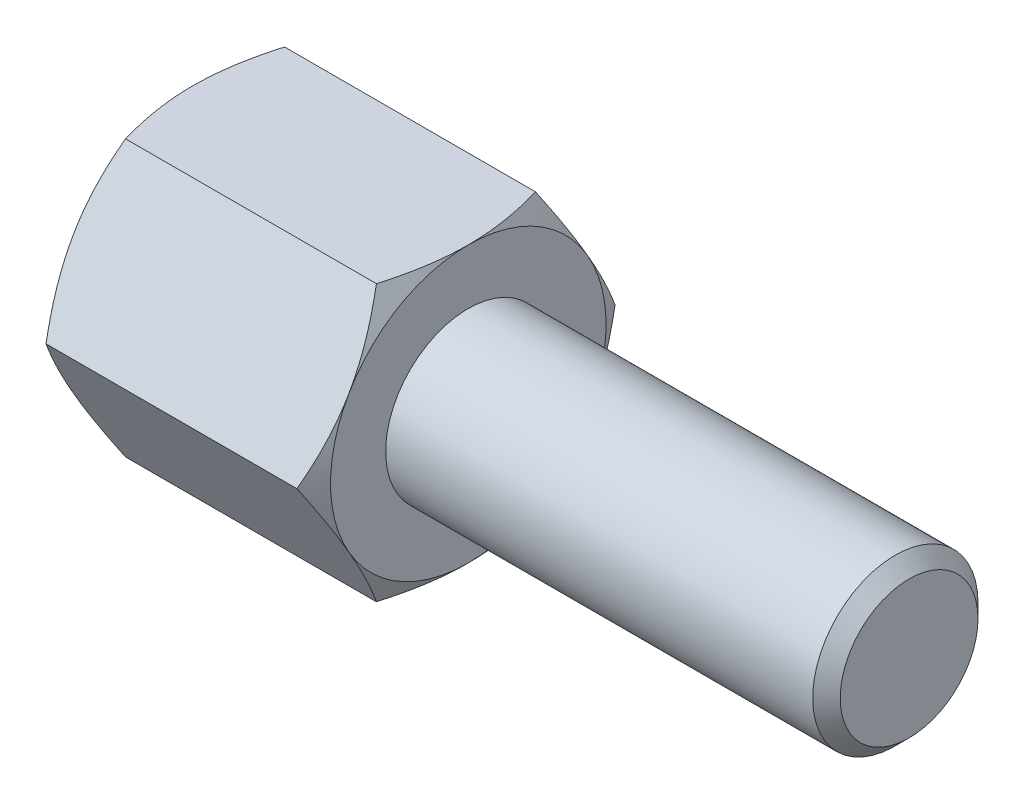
SolidWorks part; units mm, degrees
ref_plane "Front Plane" through (0, 0, 0) normal (0, 0, 1) x (1, 0, 0)
ref_plane "Top Plane" through (0, 0, 0) normal (0, 1, 0) x (1, 0, 0)
ref_plane "Right Plane" through (0, 0, 0) normal (1, 0, 0) x (0, 0, -1)
sketch "Sketch1" plane through (0, 0, 0) normal (1, 0, 0) x (0, 0, -1)
  line L1 (1.4434, 2.5) -> (-1.4434, 2.5)
  line L2 (-1.4434, 2.5) -> (-2.8868, 0)
  line L3 (-2.8868, 0) -> (-1.4434, -2.5)
  line L4 (-1.4434, -2.5) -> (1.4434, -2.5)
  line L5 (1.4434, -2.5) -> (2.8868, 0)
  line L6 (2.8868, 0) -> (1.4434, 2.5)
  circle A0 centre (0, 0) radius 2.5 construction
  dimension "D1" = 5
extrude "Extrude2" add sketch "Sketch1" along normal mid plane 5
sketch "Sketch2" plane through (0, 0, 0) normal (0, 0, 1) x (1, 0, 0)
  line L0 (-2.5, 2.5) -> (-1, 5.0981)
  line L1 (-2.5, 5.5) -> (-2.5, 2.5)
  line L3 (0, 0) -> (50000, 0) construction
  arc A0 (-1, 5.0981) -> (-2.5, 5.5) centre (-1.6962, 5.5) ccw
  dimension "D1" = 30
  dimension "D2" = 3
revolve "Cut-Revolve1" cut sketch "Sketch2" angle 360 about L3
mirror "Mirror1" about plane through (0, 0, 0) normal (1, 0, 0) of "Cut-Revolve1"
sketch "Sketch3" plane through (-2.5, 0, 0) normal (-1, 0, 0) x (0, 0, 1)
  circle A0 centre (0, 0) radius 1.25
  dimension "D1" = 2.5
extrude "Extrude3" cut sketch "Sketch3" against normal blind 3
sketch "Sketch4" plane through (0, 0, 0) normal (0, 0, 1) x (1, 0, 0)
  line L0 (0.5, 0) -> (0.5, 1.25)
  line L1 (2.2767, 0) -> (-2.2767, 0) construction
  line L2 (0.5, 1.25) -> (1.2217, 0)
  line L3 (1.2217, 0) -> (0.5, 0)
  line L4 (-2.5, 1.25) -> (-2.5, -1.25) construction
  point P4 (-2.5, 0)
  dimension "D1" = 30
  dimension "D2" = 1.25
  dimension "D3" = 3
revolve "Cut-Revolve2" cut sketch "Sketch4" angle 360 about L3
sketch "Sketch5" plane through (2.5, 0, 0) normal (1, 0, 0) x (0, 0, -1)
  circle A0 centre (0, 0) radius 1.5
  dimension "D1" = 3
extrude "Extrude4" add sketch "Sketch5" along normal blind 8
chamfer "Chamfer1" distance 0.25 angle 45 1 edges at (10.5, 0, -1.5)
equation "\"D2@Sketch4\" = \"D1@Sketch3\"/2"
